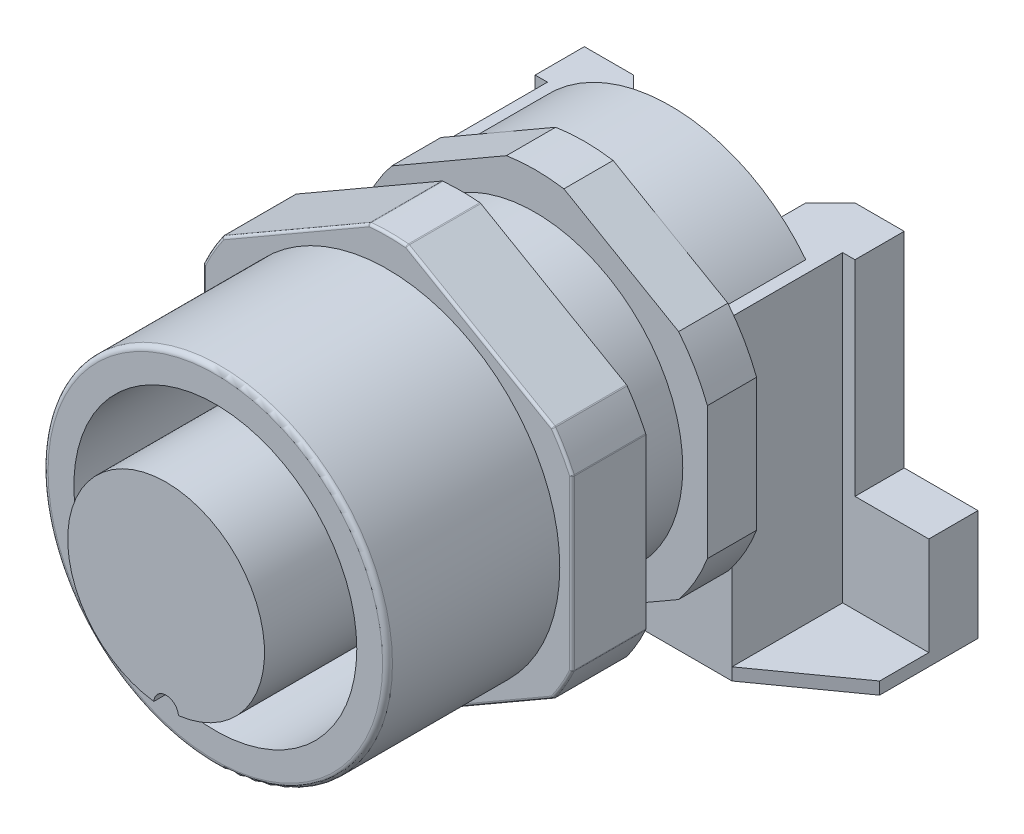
SolidWorks part; units mm, degrees
ref_plane "Plano frontal" through (0, 0, 0) normal (0, 0, 1) x (1, 0, 0)
ref_plane "Plano superior" through (0, 0, 0) normal (0, 1, 0) x (1, 0, 0)
ref_plane "Plano direito" through (0, 0, 0) normal (1, 0, 0) x (0, 0, -1)
sketch "Esboço1" plane through (0, 0, 0) normal (0, 0, 1) x (1, 0, 0)
  line L1 (7.5, 4.3301) -> (0, 8.6603)
  line L2 (0, 8.6603) -> (-7.5, 4.3301)
  line L3 (-7.5, 4.3301) -> (-7.5, -4.3301)
  line L4 (-7.5, -4.3301) -> (0, -8.6603)
  line L5 (0, -8.6603) -> (7.5, -4.3301)
  line L6 (7.5, -4.3301) -> (7.5, 4.3301)
  circle A0 centre (0, 0) radius 7.5 construction
  dimension "D1" = 15
extrude "Extrusão1" add sketch "Esboço1" along normal blind 3
fillet "Filete1" radius 0.1 6 edges at (3.75, -6.4952, 3) (-3.75, -6.4952, 3) (-7.5, 0, 3) (-3.75, 6.4952, 3) (3.75, 6.4952, 3) (7.5, 0, 3)
sketch "Esboço2" plane through (0, 0, 3) normal (0, 0, 1) x (1, 0, 0)
  line L0 (0, 8.5448) -> (0, -8.5448) construction
  circle A0 centre (0, 0) radius 8.25
  circle A1 centre (0, 0) radius 10.2204
  dimension "D1" = 16.5
extrude "Extrusão2" cut sketch "Esboço2" against normal through all
fillet "Filete2" radius 0.1 30 edges at (7.5, -3.4369, 1.45) (7.5, 3.4369, 1.45) (7.4936, -3.4508, 2.9352) (7.4948, 3.4482, 2.9317) (6.7265, 4.7767, 1.45) (0.7735, 8.2137, 1.45) (6.7353, 4.7643, 2.9352) (0.7612, 8.2148, 2.9317) (-0.7735, 8.2137, 1.45) (-6.7265, 4.7767, 1.45) (-0.7583, 8.2151, 2.9352) (-6.7336, 4.7666, 2.9317) (-7.5, 3.4369, 1.45) (-7.5, -3.4369, 1.45) (-7.4936, 3.4508, 2.9352) (-7.4948, -3.4482, 2.9317) (-6.7265, -4.7767, 1.45) (-0.7735, -8.2137, 1.45) (-6.7353, -4.7643, 2.9352) (-0.7612, -8.2148, 2.9317) (0.7735, -8.2137, 1.45) (6.7265, -4.7767, 1.45) (0.7583, -8.2151, 2.9352) (6.7336, -4.7666, 2.9317) (7.1447, 4.125, 3) (0, 8.25, 3) (-7.1447, 4.125, 3) (-7.1447, -4.125, 3) (7.1447, -4.125, 3) (0, -8.25, 3)
sketch "Esboço3" plane through (0, 0, 3) normal (0, 0, 1) x (1, 0, 0)
  line L0 (-7.1039, 0) -> (6.4907, 0) construction
  circle A0 centre (0, 0) radius 7
  dimension "D1" = 14
extrude "Extrusão3" add sketch "Esboço3" along normal blind 7
fillet "Filete3" radius 0.2 1 edges at (7, 0, 10)
sketch "Esboço4" plane through (0, 0, 10) normal (0, 0, 1) x (1, 0, 0)
  line L0 (0, 0) -> (0, -5.0767) construction
  arc A0 (0.499, -3.9688) -> (-0.499, -3.9688) centre (0, 0) ccw
  arc A1 (0.499, -3.9688) -> (-0.499, -3.9688) centre (0, -4) ccw
  circle A2 centre (0, 0) radius 5.75
  point P0 (0, 0)
  point P5 (0, -4)
  dimension "D1" = 8
  dimension "D2" = 1
  dimension "D3" = 11.5
extrude "Extrusão4" cut sketch "Esboço4" against normal blind 8.5
sketch "Esboço5" plane through (0, 0, 10) normal (0, 0, 1) x (1, 0, 0)
  line L0 (0, 0) -> (0, -5.75) construction
  arc A0 (0.499, -3.9688) -> (-0.499, -3.9688) centre (0, 0) ccw
  circle A1 centre (0, 0) radius 5.75 construction
  arc A2 (0.499, -3.9688) -> (-0.499, -3.9688) centre (0, -4) ccw
  point P0 (0, 0)
  point P5 (0, -4)
extrude "Extrusão5" add sketch "Esboço5" along normal blind 2
sketch "Esboço8" plane through (0, 0, 0) normal (0, 0, -1) x (-1, 0, 0)
  circle A0 centre (0, 0) radius 6
  point P0 (0, 0)
  dimension "D1" = 12
extrude "Extrusão7" add sketch "Esboço8" along normal blind 3
sketch "Esboço9" plane through (0, 0, -3) normal (0, 0, -1) x (-1, 0, 0)
  line L1 (7, -4.0415) -> (7, 4.0415)
  line L2 (7, 4.0415) -> (0, 8.0829)
  line L3 (0, 8.0829) -> (-7, 4.0415)
  line L4 (-7, 4.0415) -> (-7, -4.0415)
  line L5 (-7, -4.0415) -> (0, -8.0829)
  line L6 (0, -8.0829) -> (7, -4.0415)
  circle A0 centre (0, 0) radius 7 construction
  point P0 (0, 0)
  dimension "D1" = 14
extrude "Extrusão8" add sketch "Esboço9" along normal blind 2
sketch "Esboço10" plane through (0, 0, -5) normal (0, 0, -1) x (-1, 0, 0)
  circle A0 centre (0, 0) radius 7.5
  circle A1 centre (0, 0) radius 8.9431
  dimension "D1" = 15
extrude "Extrusão9" cut sketch "Esboço10" against normal blind 2
sketch "Esboço11" plane through (0, 0, -5) normal (0, 0, -1) x (-1, 0, 0)
  line L0 (0, 0) -> (0, -13.2961) construction
  line L3 (-5.5, 4.3301) -> (-5.5, -10)
  line L4 (-5.5, -10) -> (-2.5, -10)
  line L5 (5.5, 4.3301) -> (5.5, -10)
  line L6 (-2.5, -10) -> (-2.5, -8.5)
  line L7 (-2.5, -8.5) -> (2.5, -8.5)
  line L8 (2.5, -10) -> (2.5, -8.5)
  line L9 (2.5, -10) -> (5.5, -10)
  arc A1 (5.5, 4.3301) -> (-5.5, 4.3301) centre (0, 0) ccw
  point P11 (0, -9.25)
  dimension "D1" = 10
  dimension "D2" = 1.5
  dimension "D3" = 5
extrude "Extrusão10" add sketch "Esboço11" along normal blind 3.5
sketch "Esboço12" plane through (0, 0, -8.5) normal (0, 0, -1) x (-1, 0, 0)
  line L0 (-4.9497, 4.9497) -> (4.9497, -4.9497) construction
  line L2 (4.9497, 4.9497) -> (-4.9497, -4.9497) construction
  line L4 (-2.5, -8.5) -> (2.5, -8.5) construction
  circle A0 centre (0, 0) radius 0.5
  circle A1 centre (-2.4749, 2.4749) radius 0.5
  circle A2 centre (2.4749, 2.4749) radius 0.5
  circle A3 centre (2.4749, -2.4749) radius 0.5
  circle A4 centre (-2.4749, -2.4749) radius 0.5
  point P11 (-2.4749, -2.4749)
  point P12 (2.4749, 2.4749)
  point P13 (-2.4749, 2.4749)
  point P15 (2.4749, -2.4749)
  dimension "D7" = 1
  dimension "D8" = 1
  dimension "D9" = 1
  dimension "D10" = 1
  dimension "D11" = 1
  dimension "D1" = 90
  dimension "D2" = 45
  dimension "D3" = 3.5
  dimension "D4" = 3.5
  dimension "D5" = 3.5
  dimension "D6" = 3.5
extrude "Extrusão11" [suppressed] add sketch "Esboço12" along normal blind 6
fillet "Filete8" [suppressed] radius 0.5
sketch "Esboço13" plane through (0, -10, 0) normal (0, -1, 0) x (1, 0, 0)
  line L0 (-2.5, -8.5) -> (-2.5, -5) construction
  line L1 (-3.5, -5) -> (-9.5, -5)
  line L2 (-3.5, -5) -> (-3.5, -11.5)
  line L3 (-3.5, -11.5) -> (-9.5, -11.5)
  line L4 (-9.5, -5) -> (-9.5, -11.5)
  line L5 (0, 0) -> (0, -16.4078) construction
  line L6 (9.5, -5) -> (9.5, -11.5)
  line L7 (3.5, -11.5) -> (9.5, -11.5)
  line L8 (3.5, -5) -> (3.5, -11.5)
  line L9 (3.5, -5) -> (9.5, -5)
  line L10 (-2.5, -5) -> (-5.5, -5) construction
  dimension "D1" = 6
  dimension "D2" = 6.5
  dimension "D3" = 1
extrude "Extrusão12" add sketch "Esboço13" against normal up to vertex
sketch "Esboço15" plane through (9.5, 0, 0) normal (1, 0, 0) x (0, 0, -1)
  line L0 (11.5, 4.3301) -> (11.5, -10) construction
  line L1 (5, 4.3301) -> (9.5, 4.3301)
  line L2 (5, 4.3301) -> (5, -8)
  line L3 (5, -8) -> (9.5, -8)
  line L4 (9.5, 4.3301) -> (9.5, -8)
  dimension "D1" = 2
extrude "Extrusão13" cut sketch "Esboço15" against normal blind 3.5
sketch "Esboço16" plane through (-9.5, 0, 0) normal (-1, 0, 0) x (0, 0, 1)
  line L0 (-11.5, 4.3301) -> (-11.5, -10) construction
  line L1 (-5, 4.3301) -> (-9.5, 4.3301)
  line L2 (-5, 4.3301) -> (-5, -8)
  line L3 (-5, -8) -> (-9.5, -8)
  line L4 (-9.5, 4.3301) -> (-9.5, -8)
  line L5 (-5, -10) -> (-11.5, -10) construction
  dimension "D1" = 2
  dimension "D2" = 2
extrude "Extrusão14" cut sketch "Esboço16" against normal blind 3.5
sketch "Esboço17" plane through (0, -10, 0) normal (0, -1, 0) x (1, 0, 0)
  line L0 (6, -5) -> (9.5, -7.5)
  line L1 (0, 0) -> (0, -15.8968) construction
  line L2 (-6, 0) -> (6, 0) construction
  line L4 (-6, -5) -> (-9.5, -5)
  line L5 (9.5, -5) -> (9.5, -7.5)
  line L6 (6, -5) -> (9.5, -5)
  line L7 (-9.5, -5) -> (-9.5, -7.5)
  line L8 (-2.5, -5) -> (-9.5, -5) construction
  line L9 (-6, -5) -> (-9.5, -7.5)
  dimension "D1" = 3.5
extrude "Extrusão18" cut sketch "Esboço17" against normal blind 3.5
chamfer "Chanfro1" distance 1 angle 45 2 edges at (3.5, -2.8349, -11.5) (-3.5, -2.8349, -11.5)
sketch "Esboço18" plane through (0, 0, -11.5) normal (0, 0, -1) x (-1, 0, 0)
  line L0 (-4.5, -10) -> (-9.5, -10) construction
  line L1 (-9.5, 4.3301) -> (-6.5, 4.3301)
  line L2 (-9.5, 4.3301) -> (-9.5, -4)
  line L3 (-9.5, -4) -> (-6.5, -4)
  line L4 (-6.5, 4.3301) -> (-6.5, -4)
  line L5 (0, 0) -> (0, -12.5251) construction
  line L6 (6.5, 4.3301) -> (6.5, -4)
  line L7 (9.5, -4) -> (6.5, -4)
  line L8 (9.5, 4.3301) -> (9.5, -4)
  line L9 (9.5, 4.3301) -> (6.5, 4.3301)
  dimension "D1" = 6
  dimension "D2" = 3
extrude "Extrusão19" cut sketch "Esboço18" against normal blind 3.5
sketch "Sketch1" plane through (0, -10, 0) normal (0, -1, 0) x (1, 0, 0)
  line L1 (-13.5899, -13.2949) -> (16.4277, -13.2949)
  line L2 (-13.5899, -13.2949) -> (-13.5899, -3.9311)
  line L3 (-13.5899, -3.9311) -> (16.4277, -3.9311)
  line L4 (16.4277, -13.2949) -> (16.4277, -3.9311)
extrude "Cut-Extrude1" cut sketch "Sketch1" against normal blind 1.5
